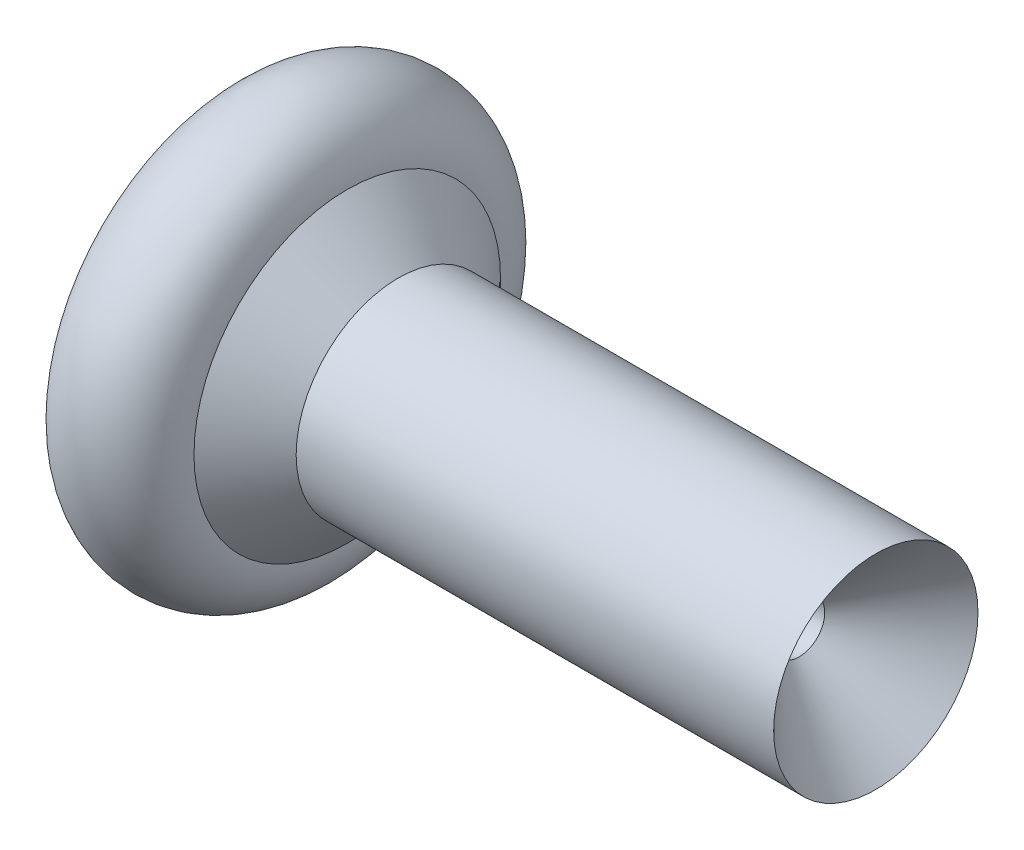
SolidWorks part; units mm, degrees
ref_plane "Front Plane" through (0, 0, 0) normal (0, 0, 1) x (1, 0, 0)
ref_plane "Top Plane" through (0, 0, 0) normal (0, 1, 0) x (1, 0, 0)
ref_plane "Right Plane" through (0, 0, 0) normal (1, 0, 0) x (0, 0, -1)
sketch "Sketch1" plane through (0, 0, 0) normal (0, 1, 0) x (1, 0, 0)
  line L0 (0, 15) -> (0, 30)
  line L1 (24, 30) -> (34, 20)
  line L2 (34, 20) -> (127.4748, 20)
  line L3 (127.4748, 20) -> (112.4748, 5)
  line L4 (20, 15) -> (20, 5)
  line L5 (0, 15) -> (20, 15)
  line L6 (0, 0) -> (163.9436, 0) construction
  line L7 (82.4748, 0) -> (62.4748, 0)
  line L8 (82.4748, 0) -> (82.4748, 5)
  line L9 (82.4748, 5) -> (112.4748, 5)
  line L10 (20, 5) -> (35, 5)
  line L11 (62.4748, 0) -> (35, 10)
  line L12 (35, 5) -> (35, 10)
  arc A0 (0, 30) -> (24, 30) centre (12, 30) cw
  dimension "D3" = 12
  dimension "D1" = 15
  dimension "D2" = 20
  dimension "D4" = 20
  dimension "D5" = 135
  dimension "D6" = 30
  dimension "D7" = 15
  dimension "D8" = 160
  dimension "D9" = 20
  dimension "D10" = 135
  dimension "D11" = 10
  dimension "D12" = 30
  dimension "D13" = 15
  dimension "D14" = 5
revolve "Revolve1" add sketch "Sketch1" angle 360 about L6
